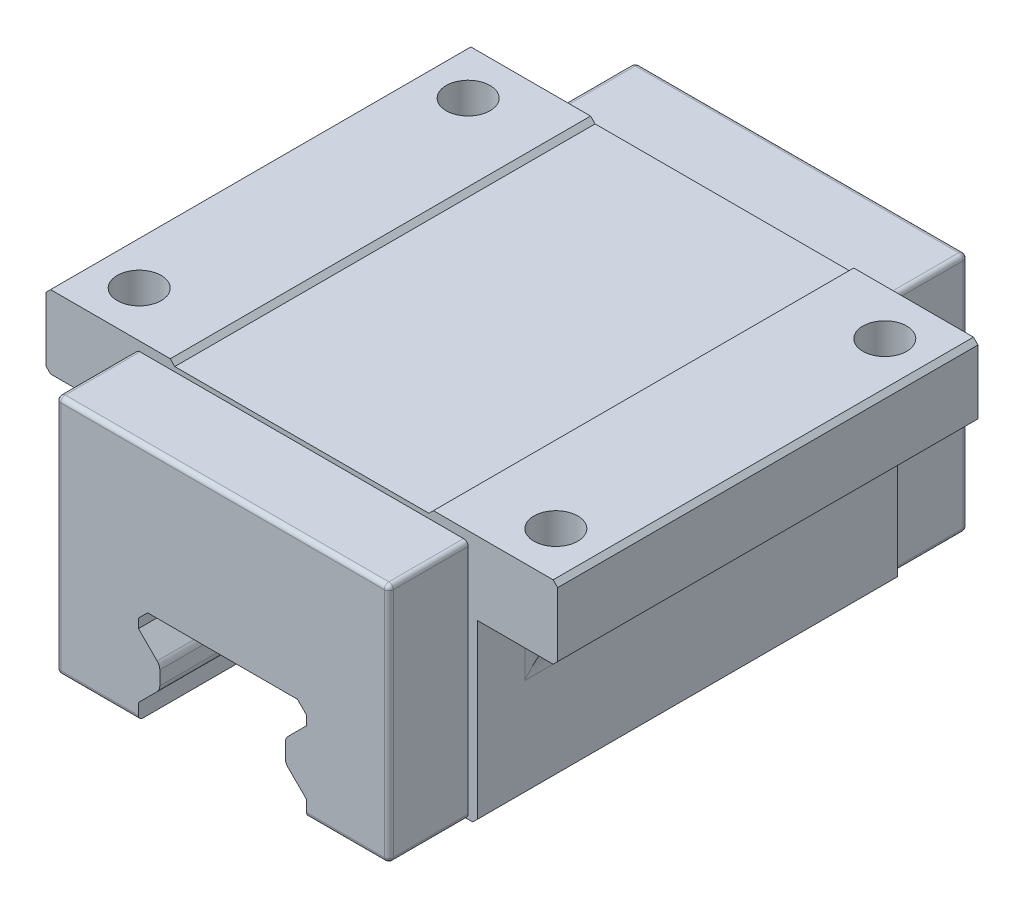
SolidWorks part; units mm, degrees
ref_plane "Front Plane" through (0, 0, 0) normal (0, 0, 1) x (1, 0, 0)
ref_plane "Top Plane" through (0, 0, 0) normal (0, 1, 0) x (1, 0, 0)
ref_plane "Right Plane" through (0, 0, 0) normal (1, 0, 0) x (0, 0, -1)
sketch "Sketch1" plane through (0, 0, 0) normal (0, 0, 1) x (1, 0, 0)
  line L1 (-24, 5.8) -> (24, 5.8)
  line L2 (-24, 5.8) -> (-24, 40)
  line L3 (-24, 40) -> (24, 40)
  line L4 (24, 5.8) -> (24, 40)
  line L5 (-24, 5.8) -> (24, 40) construction
  line L6 (-24, 40) -> (24, 5.8) construction
  point P0 (0, 22.9)
  dimension "D1" = 40
  dimension "D2" = 5.8
  dimension "D3" = 48
extrude "Boss-Extrude1" add sketch "Sketch1" along normal mid plane 57.5
sketch "Sketch2" plane through (0, 0, 0) normal (0, 0, 1) x (1, 0, 0)
  line L0 (-24, 5.8) -> (24, 5.8) construction
  line L1 (-22.75, 5.8) -> (22.75, 5.8)
  line L2 (-22.75, 5.8) -> (-22.75, 38.75)
  line L3 (-22.75, 38.75) -> (22.75, 38.75)
  line L4 (22.75, 5.8) -> (22.75, 38.75)
  line L5 (-22.75, 38.75) -> (-24, 38.75) construction
  line L6 (-24, 40) -> (-24, 5.8) construction
  line L7 (22.75, 38.75) -> (22.75, 40) construction
  line L8 (24, 40) -> (-24, 40) construction
  line L9 (22.75, 38.75) -> (24, 38.75) construction
  line L10 (24, 5.8) -> (24, 40) construction
  point P9 (0, 38.75)
  dimension "D1" = 1.25
extrude "Boss-Extrude2" add sketch "Sketch2" along normal mid plane 79.2
sketch "Sketch3" plane through (0, 0, 39.6) normal (0, 0, 1) x (1, 0, 0)
  line L1 (-11.5, 19.2) -> (11.5, 19.2)
  line L2 (-11.5, 19.2) -> (-11.5, 0)
  line L3 (-11.5, 0) -> (11.5, 0)
  line L4 (11.5, 19.2) -> (11.5, 0)
  line L5 (-11.5, 19.2) -> (11.5, 0) construction
  line L6 (-11.5, 0) -> (11.5, 19.2) construction
  point P0 (0, 9.6)
  dimension "D1" = 23
  dimension "D2" = 19.2
extrude "Cut-Extrude1" cut sketch "Sketch3" against normal through all
sketch "Sketch4" plane through (0, 0, 39.6) normal (0, 0, 1) x (1, 0, 0)
  line L0 (-11.5, 16.7) -> (-11.5, 7.95)
  line L1 (-11.5, 19.2) -> (-11.5, 5.8) construction
  line L2 (-11.5, 7.95) -> (-8.5833, 10.8667)
  line L3 (-8.5833, 10.8667) -> (-8.5833, 13.7833)
  line L4 (-8.5833, 13.7833) -> (-11.5, 16.7)
  line L5 (11.5, 19.2) -> (-11.5, 19.2) construction
  line L6 (-8.5833, 13.7833) -> (-11.5, 13.7833) construction
  line L7 (-8.5833, 10.8667) -> (-11.5, 10.8667) construction
  line L8 (-10.0417, 13.7833) -> (-10.0417, 10.8667) construction
  line L9 (0, 0) -> (0, 19.2) construction
  line L10 (10.0417, 13.7833) -> (10.0417, 10.8667) construction
  line L11 (8.5833, 10.8667) -> (11.5, 10.8667) construction
  line L12 (8.5833, 13.7833) -> (11.5, 13.7833) construction
  line L13 (8.5833, 13.7833) -> (11.5, 16.7)
  line L14 (8.5833, 10.8667) -> (8.5833, 13.7833)
  line L15 (11.5, 7.95) -> (8.5833, 10.8667)
  line L16 (11.5, 16.7) -> (11.5, 7.95)
extrude "Boss-Extrude3" add sketch "Sketch4" against normal up to surface (79.2 mm away)
chamfer "Chamfer1" distance 1.25 angle 45 2 edges at (11.5, 19.2, 0) (-11.5, 19.2, 0)
fillet "Fillet1" radius 1.25 4 edges at (8.5833, 10.8667, 0) (8.5833, 13.7833, 0) (-8.5833, 10.8667, 0) (-8.5833, 13.7833, 0)
sketch "Sketch5" plane through (0, 0, 28.75) normal (0, 0, 1) x (1, 0, 0)
  line L0 (24, 40) -> (-24, 40) construction
  line L1 (-18, 40) -> (18, 40)
  line L2 (-18, 40) -> (-18, 39.38)
  line L3 (-18, 39.38) -> (18, 39.38)
  line L4 (18, 40) -> (18, 39.38)
  point P6 (0, 39.38)
  dimension "D1" = 36
  dimension "D2" = 0.62
extrude "Cut-Extrude2" cut sketch "Sketch5" against normal through all
chamfer "Chamfer2" distance 0.62 angle 45 6 edges at (24, 40, 0) (24, 5.8, 0) (-24, 5.8, 0) (-24, 40, 0) (18, 39.38, 0) (-18, 39.38, 0)
fillet "Fillet2" radius 0.62 18 edges at (-22.75, 5.8, -34.175) (17.125, 5.8, 39.6) (17.125, 5.8, -39.6) (-22.75, 5.8, 34.175) (-17.125, 5.8, -39.6) (-17.125, 5.8, 39.6) (22.75, 5.8, 34.175) (-22.75, 22.275, 39.6) (-22.75, 22.275, -39.6) (-22.75, 38.75, 34.175) (22.75, 38.75, 34.175) (22.75, 22.275, 39.6) (22.75, 22.275, -39.6) (0, 38.75, 39.6) (0, 38.75, -39.6) (22.75, 5.8, -34.175) (22.75, 38.75, -34.175) (-22.75, 38.75, -34.175)
sketch "Sketch7" plane through (0, 0, 0) normal (0, 0, 1) x (1, 0, 0)
  line L0 (-23.38, 40) -> (-35, 40)
  line L1 (-35, 40) -> (-35, 30)
  line L2 (-23.38, 40) -> (-23.38, 19.62)
  line L3 (-24, 39.38) -> (-24, 6.42) construction
  line L4 (-24, 19.62) -> (-23.38, 19.62)
  line L5 (-35, 30) -> (-34.38, 30)
  line L6 (0, 0) -> (0, 39.38) construction
  line L7 (-17.38, 39.38) -> (17.38, 39.38) construction
  line L8 (35, 30) -> (34.38, 30)
  line L9 (24, 19.62) -> (23.38, 19.62)
  line L10 (23.38, 40) -> (23.38, 19.62)
  line L11 (35, 40) -> (35, 30)
  line L12 (23.38, 40) -> (35, 40)
  arc A1 (-34.38, 30) -> (-24, 19.62) centre (-34.38, 19.62) cw
  arc A2 (34.38, 30) -> (24, 19.62) centre (34.38, 19.62) ccw
  point P22 (-34.69, 30)
  dimension "D1" = 70
  dimension "D2" = 10
  dimension "D3" = 0.62
extrude "Boss-Extrude4" add sketch "Sketch7" along normal mid plane 32.5
sketch "Sketch8" plane through (0, 0, 0) normal (0, 0, 1) x (1, 0, 0)
  line L0 (-35, 30) -> (-35, 40)
  line L9 (35, 30) -> (35, 40)
  line L10 (35, 30) -> (23.38, 30)
  line L11 (35, 40) -> (23.38, 40)
  line L13 (23.38, 40) -> (23.38, 30)
  line L14 (-35, 30) -> (-22.75, 30)
  line L15 (-35, 40) -> (-22.75, 40)
  line L16 (-22.75, 30) -> (-22.75, 40)
  line L17 (-22.75, 38.13) -> (-22.75, 6.42) construction
extrude "Boss-Extrude5" add sketch "Sketch8" along normal mid plane 57.5
chamfer "Chamfer3" distance 0.62 angle 45 4 edges at (-35, 30, 0) (-35, 40, 0) (35, 30, 0) (35, 40, 0)
fillet "Fillet3" radius 6 4 edges at (-24, 24.81, 16.25) (-24, 24.81, -16.25) (24, 24.81, -16.25) (24, 24.81, 16.25)
sketch "Sketch6" plane through (0, 40, 0) normal (0, 1, 0) x (1, 0, 0)
  line L1 (0, 0) -> (28.5, -22.5) construction
  line L3 (0, 0) -> (-28.5, -22.5) construction
  circle A1 centre (-28.5, -22.5) radius 3
  circle A2 centre (28.5, -22.5) radius 3
  dimension "D1" = 6
  dimension "D2" = 57
  dimension "D3" = 22.5
extrude "Cut-Extrude3" cut sketch "Sketch6" against normal blind 10
mirror "Mirror1" about plane through (0, 0, 0) normal (0, 0, 1) of "Cut-Extrude3"
equation "\"D2@Sketch4\"=\"D1@Sketch4\"*3.5"
